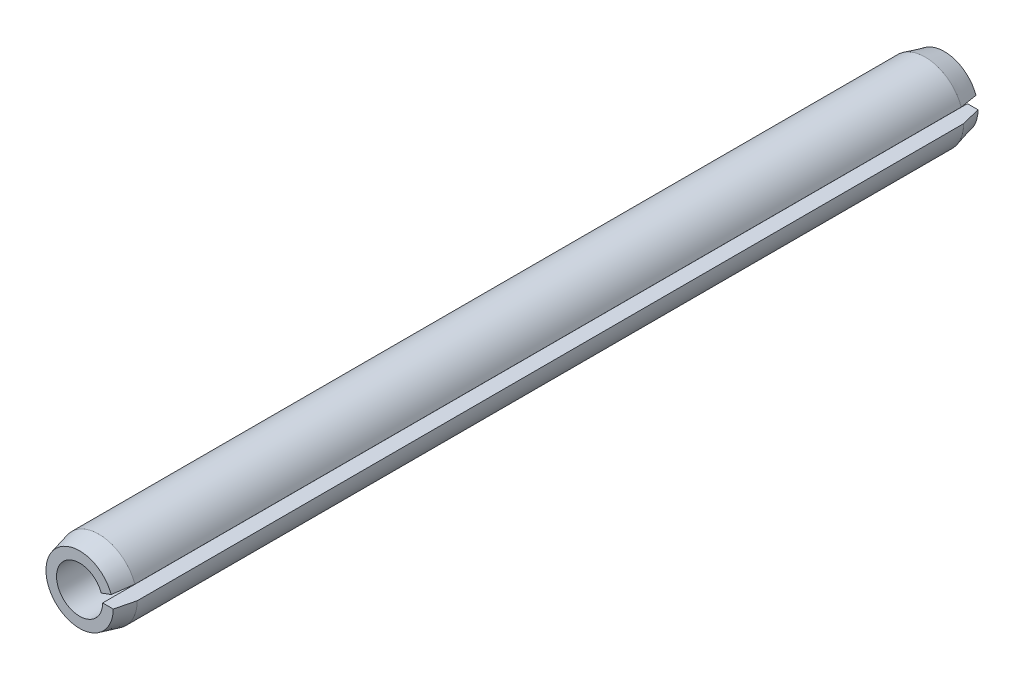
SolidWorks part; units mm, degrees
ref_plane "Plan de face" through (0, 0, 0) normal (0, 0, 1) x (1, 0, 0)
ref_plane "Plan de dessus" through (0, 0, 0) normal (0, 1, 0) x (1, 0, 0)
ref_plane "Plan de droite" through (0, 0, 0) normal (1, 0, 0) x (0, 0, -1)
sketch "Esquisse1" plane through (0, 0, 0) normal (0, 0, 1) x (1, 0, 0)
  line L0 (1.2, 0) -> (2, 0)
  line L1 (1.1276, 0.4104) -> (1.8794, 0.684)
  line L2 (0, 0) -> (2.5584, 0.9312) construction
  arc A0 (1.8794, 0.684) -> (2, 0) centre (0, 0) ccw
  arc A1 (1.1276, 0.4104) -> (1.2, 0) centre (0, 0) ccw
  circle A3 centre (0, 0) radius 2 construction
  circle A4 centre (0, 0) radius 1.2 construction
  point P1 (1.1476, 0.3508)
  point P6 (1.9126, 0.5847)
  dimension "D2" = 4
  dimension "D3" = 20
  dimension "D1" = 0.8
extrude "Boss.-Extru.1" add sketch "Esquisse1" along normal blind 45
chamfer "Chanfrein1" distance 0.25 distance2 1 1 edges at (-1.9696, -0.3473, 0)
chamfer "Chanfrein2" distance 1 distance2 0.25 1 edges at (-1.9696, -0.3473, 45)
